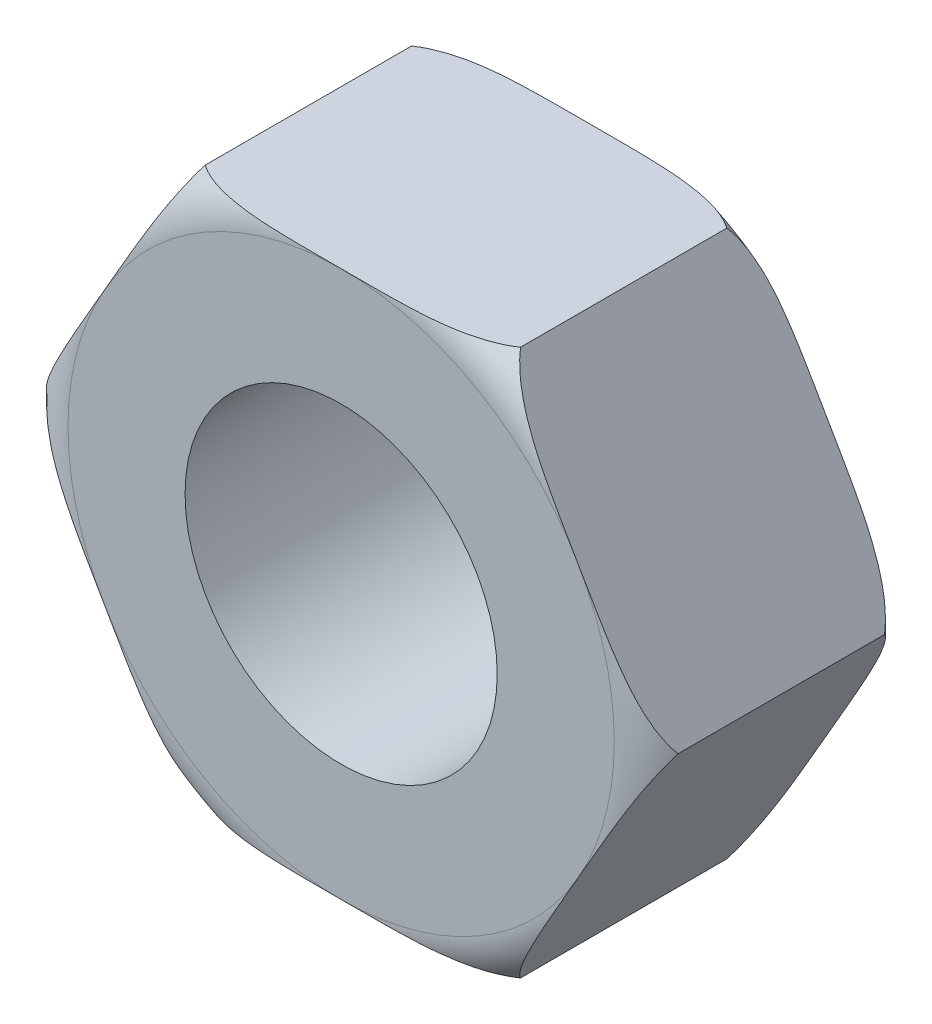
SolidWorks part; units mm, degrees
ref_plane "Plane1" through (0, 0, 0) normal (0, 0, 1) x (1, 0, 0)
ref_plane "Plane2" through (0, 0, 0) normal (0, 1, 0) x (1, 0, 0)
ref_plane "Plane3" through (0, 0, 0) normal (1, 0, 0) x (0, 0, -1)
sketch "Esquisse1" plane through (0, 0, 0) normal (0, 0, 1) x (1, 0, 0)
  line L0 (0, 0) -> (0, 60.5083) construction
  line L1 (0, 0) -> (52.6683, 0) construction
  line L2 (-4.0415, 0) -> (-2.0207, 3.5)
  line L3 (-2.0207, 3.5) -> (2.0207, 3.5)
  line L4 (2.0207, 3.5) -> (4.0415, 0)
  line L5 (4.0415, 0) -> (2.0207, -3.5)
  line L6 (2.0207, -3.5) -> (-2.0207, -3.5)
  line L7 (-2.0207, -3.5) -> (-4.0415, 0)
  dimension "D1" = 120
  dimension "D2" = 7
extrude "Base-Extrusion" add sketch "Esquisse1" along normal blind 3.2
sketch "Esquisse2" plane through (0, 0, 3.2) normal (0, 0, 1) x (1, 0, 0)
  circle A0 centre (0, 0) radius 2
  dimension "D1" = 4
extrude "Enlèv. mat.-Extru.1" cut sketch "Esquisse2" against normal through all
sketch "Esquisse3" plane through (0, 0, 0) normal (0, 1, 0) x (1, 0, 0)
  line L0 (0, 0) -> (0, -2.6293) construction
  line L1 (0, 0) -> (0, -3.2) construction
  line L2 (-2.0207, 0) -> (2.0207, 0) construction
  line L3 (-4.0415, -3.2) -> (-4.0415, 0) construction
  line L4 (-4.0415, -0.2777) -> (-4.0415, 0)
  line L5 (-4.0415, 0) -> (-3.5, 0)
  arc A0 (-3.5, 0) -> (-4.0415, -0.2777) centre (-3.5, -0.6667) ccw
  dimension "D1" = 0.6667
  dimension "D2" = 3.5
revolve "Enlever de la matière-Révolution1" cut sketch "Esquisse3" angle 360 about L0
ref_plane "Plan4" through (0, 0, 1.6) normal (0, 0, -1) x (-1, 0, 0)
mirror "Symétrie1" about plane through (0, 0, 1.6) normal (0, 0, -1) of "Enlever de la matière-Révolution1"
equation "\"D1@Esquisse3\" = \"D1@Esquisse2\"/6"
equation "\"D2@Esquisse3\" = \"D2@Esquisse1\"/2"
equation "\"D1@Plan4\" = \"D1@Base-Extrusion\"/2"
